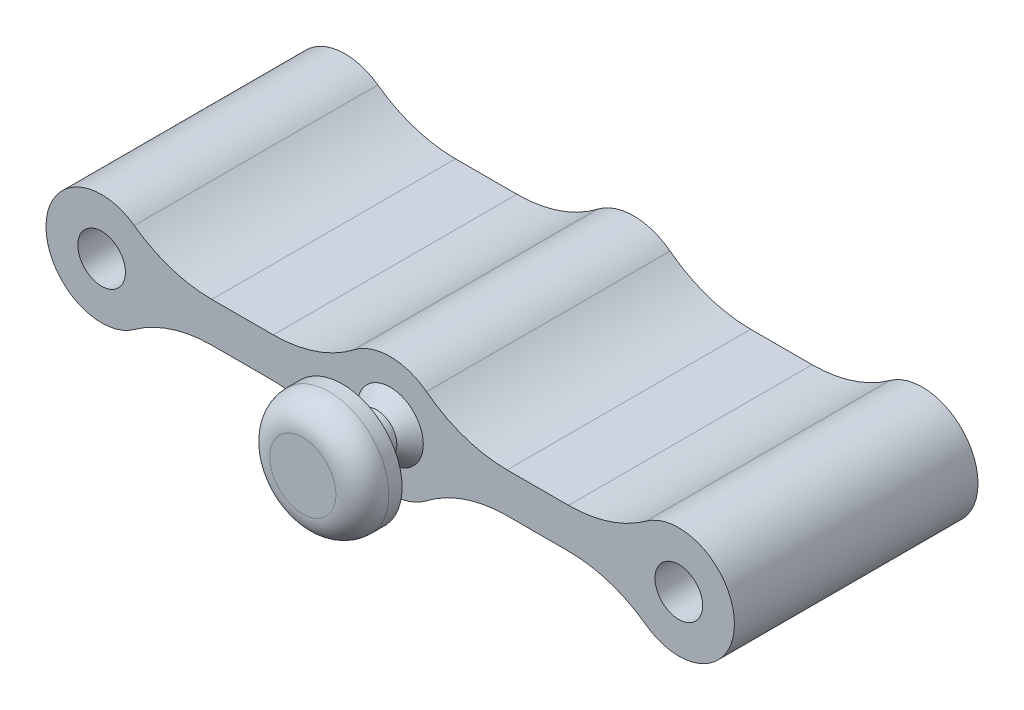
SolidWorks part; units mm, degrees
ref_plane "Front Plane" through (0, 0, 0) normal (0, 0, 1) x (1, 0, 0)
ref_plane "Top Plane" through (0, 0, 0) normal (0, 1, 0) x (1, 0, 0)
ref_plane "Right Plane" through (0, 0, 0) normal (1, 0, 0) x (0, 0, -1)
sketch3d "3DSketch1" plane through (0, 0, 0) normal (0, 0, 1) x (1, 0, 0)
sketch "Sketch1" plane through (0, 0, 0.3) normal (0, 0, 1) x (1, 0, 0)
  circle A12 centre (0, -23.5) radius 1.8
  circle A13 centre (0, -23.5) radius 4.2
  dimension "D1" = 3.6
  dimension "D2" = 8.4
extrude "Boss-Extrude1" add sketch "Sketch1" along normal blind 18.4 contours A13 | A12
sketch3d "3DSketch2"
  line L0 (0, -23.5, 18.7) -> (0, -23.5, 0.3) construction
  line L1 (0, -23.5, 18.7) -> (0, -23.5, 0.3) construction
  line L2 (0, -23.5, 18.7) -> (1.8, -23.5, 18.7) construction
  line L3 (1.8, -23.5, 18.7) -> (1.8, -23.5, -2.97) construction
  line L4 (1.8, -23.5, 18.7) -> (21.8, -23.5, 18.7) construction
  circle A2 centre (0, -23.5, 18.7) radius 1.8 construction
  point P4 (0, -23.5, 20.5)
  point P6 (0, -23.5, 18.7)
  dimension "D1" = 20
ref_plane "Plane1" through (21.8, 0, 0) normal (1, 0, 0) x (0, 0, -1)
sketch "Sketch2" plane through (0, -23.5, 0) normal (0, 1, 0) x (1, 0, 0)
  line L0 (-4.2, -18.7) -> (4.2, -18.7) construction
  line L1 (1.8, -18.7) -> (21.8, -18.7)
  line L2 (1.8, -18.7) -> (1.8, -0.3)
  line L3 (1.8, -0.3) -> (21.8, -0.3)
  line L4 (21.8, -18.7) -> (21.8, -0.3)
  line L5 (4.2, -0.3) -> (-4.2, -0.3) construction
  line L7 (1.8, -18.7) -> (1.8, 2.97) construction
extrude "Boss-Extrude2" add sketch "Sketch2" along normal mid plane 3 contours L1 L4 L3 L2
mirror "Mirror5" about plane through (21.8, 0, 0) normal (1, 0, 0)
sketch "Sketch5" plane through (0, 0, 18.7) normal (0, 0, 1) x (1, 0, 0)
  circle A0 centre (21.8, -23.5) radius 4.5
  dimension "D1" = 9
extrude "Boss-Extrude3" add sketch "Sketch5" against normal up to surface (18.4 mm away)
sketch "Sketch6" plane through (0, 0, 18.7) normal (0, 0, 1) x (1, 0, 0)
  circle A0 centre (21.8, -23.5) radius 1.5
  dimension "D1" = 3
extrude "Boss-Extrude4" add sketch "Sketch6" along normal blind 3.6
sketch "Sketch7" plane through (0, 0, 22.3) normal (0, 0, 1) x (1, 0, 0)
  circle A0 centre (21.8, -23.5) radius 4.5
  arc A1 (17.5573, -25) -> (26.0426, -25) centre (21.8, -23.5) ccw construction
extrude "Boss-Extrude5" add sketch "Sketch7" along normal blind 3
fillet "Fillet2" radius 2 1 edges at (26.3, -23.5, 25.3)
fillet "Fillet1" radius 10 8 edges at (3.923, -25, 9.5) (3.923, -22, 9.5) (17.5573, -22, 9.5) (26.0426, -22, 9.5) (26.0426, -25, 9.5) (17.5573, -25, 9.5) (39.677, -22, 9.5) (39.677, -25, 9.5)
chamfer "Chamfer1" distance 1 angle 45 2 edges at (23.3, -23.5, 22.3) (23.3, -23.5, 18.7)
